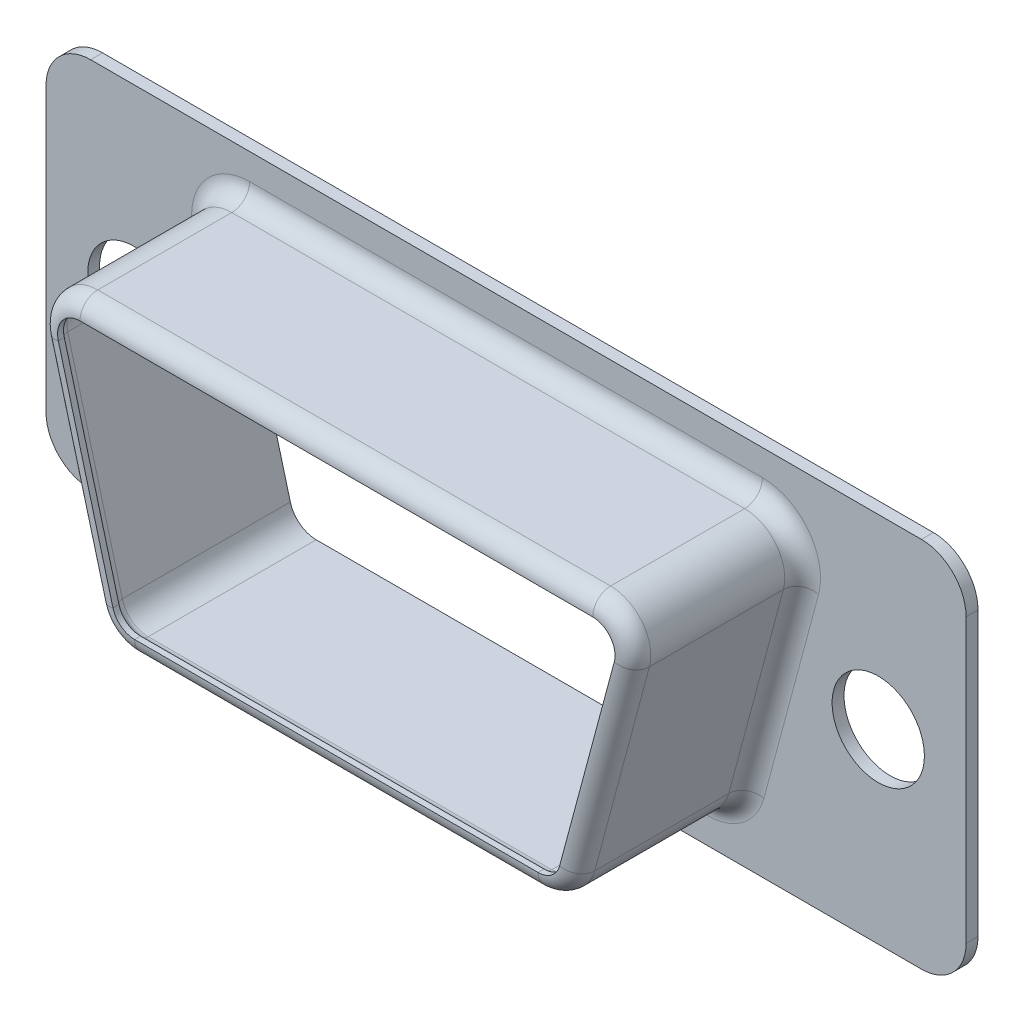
SolidWorks part; units mm, degrees
ref_plane "Front Plane" through (0, 0, 0) normal (0, 0, 1) x (1, 0, 0)
ref_plane "Top Plane" through (0, 0, 0) normal (0, 1, 0) x (1, 0, 0)
ref_plane "Right Plane" through (0, 0, 0) normal (1, 0, 0) x (0, 0, -1)
sketch "Sketch1" plane through (0, 0, 0) normal (0, 0, 1) x (1, 0, 0)
  line L0 (-135.2667, 0) -> (178.1738, 0) construction
  line L1 (0, 93.814) -> (0, -102.1772) construction
  line L2 (-10.0599, 3.0368) -> (-8.2244, -3.8132) construction
  line L3 (-13.95, 6.25) -> (13.95, 6.25)
  line L4 (-15.45, 4.75) -> (-15.45, -4.75)
  line L5 (-13.95, -6.25) -> (13.95, -6.25)
  line L6 (15.45, 4.75) -> (15.45, -4.75)
  line L7 (-15.45, 6.25) -> (15.45, -6.25) construction
  line L8 (-15.45, -6.25) -> (15.45, 6.25) construction
  line L9 (-8.611, 4.925) -> (8.611, 4.925) construction
  line L10 (10.0599, 3.0368) -> (8.2244, -3.8132) construction
  line L11 (-6.7756, -4.925) -> (6.7756, -4.925) construction
  line L12 (-8.611, 4.175) -> (8.611, 4.175)
  line L13 (-8.25, 4) -> (8.25, -4) construction
  line L14 (-8.25, -4) -> (8.25, 4) construction
  line L15 (9.3355, 3.2309) -> (7.5, -3.6191)
  line L16 (-6.7756, -4.175) -> (6.7756, -4.175)
  line L17 (-9.3355, 3.2309) -> (-7.5, -3.6191)
  circle A0 centre (-12.5, 0) radius 1.55
  circle A1 centre (12.5, 0) radius 1.55
  arc A2 (10.0599, 3.0368) -> (8.611, 4.925) centre (8.611, 3.425) ccw construction
  arc A3 (-10.0599, 3.0368) -> (-8.611, 4.925) centre (-8.611, 3.425) cw construction
  arc A4 (6.7756, -4.925) -> (8.2244, -3.8132) centre (6.7756, -3.425) ccw construction
  arc A5 (-8.2244, -3.8132) -> (-6.7756, -4.925) centre (-6.7756, -3.425) ccw construction
  arc A6 (13.95, 6.25) -> (15.45, 4.75) centre (13.95, 4.75) cw
  arc A7 (13.95, -6.25) -> (15.45, -4.75) centre (13.95, -4.75) ccw
  arc A8 (-15.45, -4.75) -> (-13.95, -6.25) centre (-13.95, -4.75) ccw
  arc A9 (-13.95, 6.25) -> (-15.45, 4.75) centre (-13.95, 4.75) ccw
  arc A10 (9.3355, 3.2309) -> (8.611, 4.175) centre (8.611, 3.425) ccw
  arc A11 (6.7756, -4.175) -> (7.5, -3.6191) centre (6.7756, -3.425) ccw
  arc A12 (-7.5, -3.6191) -> (-6.7756, -4.175) centre (-6.7756, -3.425) ccw
  arc A13 (-9.3355, 3.2309) -> (-8.611, 4.175) centre (-8.611, 3.425) cw
  point P5 (0, 0)
  point P14 (0, 0)
  dimension "D1" = 16.5
  dimension "D6" = 1.5
  dimension "D7" = 1.5
  dimension "D2" = 1.5
  dimension "D8" = 3.1
  dimension "D3" = 30.9
  dimension "D4" = 12.5
  dimension "D5" = 12.5
  dimension "D10" = 8.35
  dimension "D11" = 105
  dimension "D12" = 105
  dimension "D13" = 15
  dimension "D9" = 0.75
extrude "Boss-Extrude1" add sketch "Sketch1" along normal blind 0.4
sketch "Sketch2" plane through (0, 0, 0.4) normal (0, 0, 1) x (1, 0, 0)
  line L12 (-6.7756, -4.175) -> (6.7756, -4.175)
  line L13 (7.5, -3.6191) -> (9.3355, 3.2309)
  line L14 (8.611, 4.175) -> (-8.611, 4.175)
  line L15 (-9.3355, 3.2309) -> (-7.5, -3.6191)
  line L16 (-6.7756, -4.175) -> (6.7756, -4.175)
  line L17 (7.5, -3.6191) -> (9.3355, 3.2309)
  line L18 (8.611, 4.175) -> (-8.611, 4.175)
  line L19 (-9.3355, 3.2309) -> (-7.5, -3.6191)
  line L24 (-6.7756, -4.775) -> (6.7756, -4.775)
  line L25 (8.0796, -3.7744) -> (9.915, 3.0756)
  line L26 (8.611, 4.775) -> (-8.611, 4.775)
  line L27 (-9.915, 3.0756) -> (-8.0796, -3.7744)
  line L28 (-6.7756, -4.775) -> (6.7756, -4.775)
  line L29 (8.0796, -3.7744) -> (9.915, 3.0756)
  line L30 (8.611, 4.775) -> (-8.611, 4.775)
  line L31 (-9.915, 3.0756) -> (-8.0796, -3.7744)
  arc A10 (-7.5, -3.6191) -> (-6.7756, -4.175) centre (-6.7756, -3.425) ccw
  arc A11 (6.7756, -4.175) -> (7.5, -3.6191) centre (6.7756, -3.425) ccw
  arc A12 (9.3355, 3.2309) -> (8.611, 4.175) centre (8.611, 3.425) ccw
  arc A13 (-8.611, 4.175) -> (-9.3355, 3.2309) centre (-8.611, 3.425) ccw
  arc A14 (-7.5, -3.6191) -> (-6.7756, -4.175) centre (-6.7756, -3.425) ccw
  arc A15 (6.7756, -4.175) -> (7.5, -3.6191) centre (6.7756, -3.425) ccw
  arc A16 (9.3355, 3.2309) -> (8.611, 4.175) centre (8.611, 3.425) ccw
  arc A17 (-8.611, 4.175) -> (-9.3355, 3.2309) centre (-8.611, 3.425) ccw
  arc A20 (-8.0796, -3.7744) -> (-6.7756, -4.775) centre (-6.7756, -3.425) ccw
  arc A21 (6.7756, -4.775) -> (8.0796, -3.7744) centre (6.7756, -3.425) ccw
  arc A22 (9.915, 3.0756) -> (8.611, 4.775) centre (8.611, 3.425) ccw
  arc A23 (-8.611, 4.775) -> (-9.915, 3.0756) centre (-8.611, 3.425) ccw
  arc A24 (-8.0796, -3.7744) -> (-6.7756, -4.775) centre (-6.7756, -3.425) ccw
  arc A25 (6.7756, -4.775) -> (8.0796, -3.7744) centre (6.7756, -3.425) ccw
  arc A26 (9.915, 3.0756) -> (8.611, 4.775) centre (8.611, 3.425) ccw
  arc A27 (-8.611, 4.775) -> (-9.915, 3.0756) centre (-8.611, 3.425) ccw
  dimension "D1" = 0.6
  dimension "D2" = 0
extrude "Boss-Extrude2" add sketch "Sketch2" along normal blind 5.7
fillet "Fillet1" radius 0.6 16 edges at (-8.9973, -0.3494, 0.4) (-9.682, 4.2468, 0.4) (0, 4.775, 0.4) (9.682, 4.2468, 0.4) (8.9973, -0.3494, 0.4) (7.5974, -4.496, 0.4) (0, -4.775, 0.4) (-9.682, 4.2468, 6.1) (0, 4.775, 6.1) (9.682, 4.2468, 6.1) (8.9973, -0.3494, 6.1) (7.5974, -4.496, 6.1) (0, -4.775, 6.1) (-7.5974, -4.496, 6.1) (-7.5974, -4.496, 0.4) (-8.9973, -0.3494, 6.1)
sketch "Sketch3" plane through (0, 0, 0) normal (0, 0, -1) x (-1, 0, 0)
  line L8 (-6.7756, -4.325) -> (6.7756, -4.325)
  line L9 (7.6449, -3.6579) -> (9.4803, 3.1921)
  line L10 (8.611, 4.325) -> (-8.611, 4.325)
  line L11 (-9.4803, 3.1921) -> (-7.6449, -3.6579)
  line L12 (-6.7756, -4.325) -> (6.7756, -4.325)
  line L13 (7.6449, -3.6579) -> (9.4803, 3.1921)
  line L14 (8.611, 4.325) -> (-8.611, 4.325)
  line L15 (-9.4803, 3.1921) -> (-7.6449, -3.6579)
  arc A8 (-7.6449, -3.6579) -> (-6.7756, -4.325) centre (-6.7756, -3.425) ccw
  arc A9 (6.7756, -4.325) -> (7.6449, -3.6579) centre (6.7756, -3.425) ccw
  arc A10 (9.4803, 3.1921) -> (8.611, 4.325) centre (8.611, 3.425) ccw
  arc A11 (-8.611, 4.325) -> (-9.4803, 3.1921) centre (-8.611, 3.425) ccw
  arc A12 (-7.6449, -3.6579) -> (-6.7756, -4.325) centre (-6.7756, -3.425) ccw
  arc A13 (6.7756, -4.325) -> (7.6449, -3.6579) centre (6.7756, -3.425) ccw
  arc A14 (9.4803, 3.1921) -> (8.611, 4.325) centre (8.611, 3.425) ccw
  arc A15 (-8.611, 4.325) -> (-9.4803, 3.1921) centre (-8.611, 3.425) ccw
  dimension "D1" = 0.15
extrude "Cut-Extrude1" cut sketch "Sketch3" against normal blind 5.9
fillet "Fillet2" radius 0.3 8 edges at (8.5626, -0.2329, 5.9) (9.325, 3.9729, 5.9) (0, 4.325, 5.9) (-9.325, 3.9729, 5.9) (-8.5626, -0.2329, 5.9) (-7.3234, -4.139, 5.9) (0, -4.325, 5.9) (7.3234, -4.139, 5.9)
